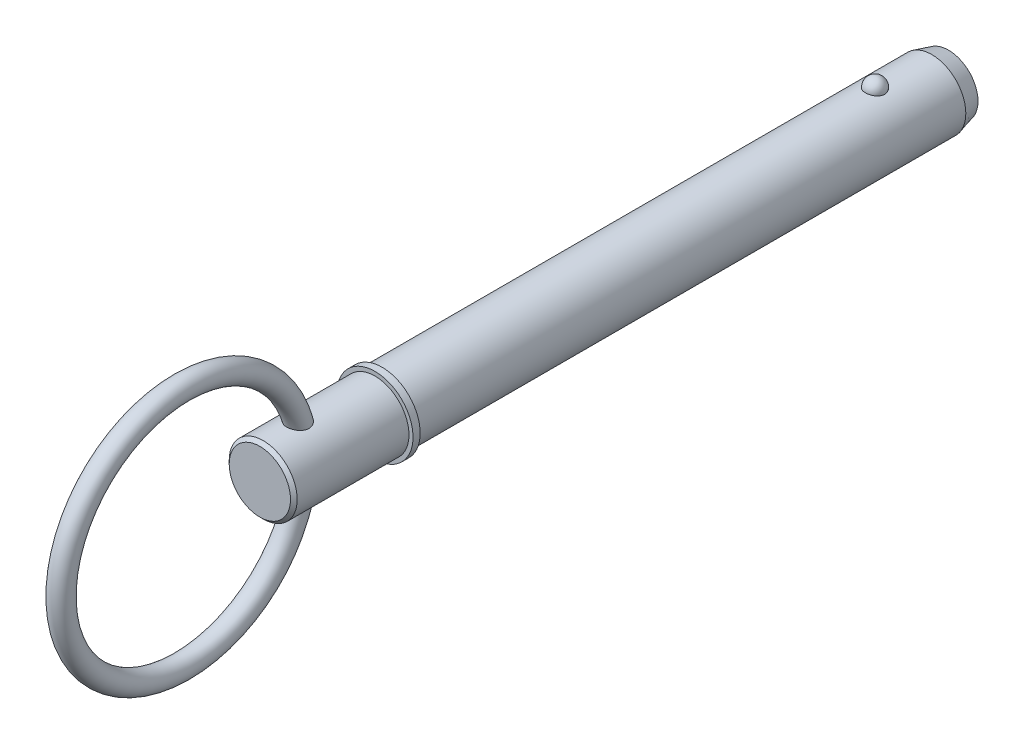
SolidWorks part; units mm, degrees
ref_plane "Front Plane" through (0, 0, 0) normal (0, 0, 1) x (1, 0, 0)
ref_plane "Top Plane" through (0, 0, 0) normal (0, 1, 0) x (1, 0, 0)
ref_plane "Right Plane" through (0, 0, 0) normal (1, 0, 0) x (0, 0, -1)
sketch "Sketch2" plane through (0, 0, 0) normal (0, 0, 1) x (1, 0, 0)
  circle A0 centre (0, 0) radius 7.145
  point P3 (0, 7.145)
  dimension "D1" = 14.29
extrude "Boss-Extrude1" add sketch "Sketch2" along normal blind 101.6
sketch "Sketch3" plane through (0, 0, 0) normal (0, 0, -1) x (-1, 0, 0)
  circle A0 centre (0, 0) radius 7.145
  dimension "D1" = 14.29
extrude "Boss-Extrude2" add sketch "Sketch3" along normal blind 17.45
chamfer "Chamfer1" distance 3.5 angle 15 1 edges at (-7.145, 0, -17.45)
sketch "Sketch18" plane through (0, 0, 0) normal (1, 0, 0) x (0, 0, -1)
  line L0 (13.95, 7.145) -> (-101.6, 7.145) construction
  line L1 (2.02, 9.165) -> (2.02, 5.125)
  line L2 (-101.6, -7.145) -> (13.95, -7.145) construction
  arc A0 (2.02, 9.165) -> (2.02, 5.125) centre (2.02, 7.145) ccw
  point P4 (0, 7.145)
  dimension "D1" = 16.31
revolve "Revolve1" add sketch "Sketch18" angle 360 about L1
sketch "Sketch19" plane through (0, 0, 0) normal (1, 0, 0) x (0, 0, -1)
  line L0 (-33.7288, 0) -> (-46.4542, 0) construction
sketch "Sketch20" plane through (0, 0, 0) normal (1, 0, 0) x (0, 0, -1)
  line L0 (-101.6, 0) -> (-101.6, 8)
  line L1 (-101.6, 7.145) -> (-101.6, -7.145) construction
  line L2 (-101.6, 8) -> (-103.1, 8)
  line L3 (-103.1, 8) -> (-103.1, 0)
  line L4 (-33.7288, 0) -> (-46.4542, 0) construction
  line L5 (-103.1, 0) -> (-101.6, 0)
  dimension "D1" = 8
  dimension "D2" = 1.5
revolve "Revolve2" add sketch "Sketch20" angle 360 about L0
sketch "Sketch21" plane through (0, 0, 101.6) normal (0, 0, -1) x (-1, 0, 0)
  circle A0 centre (0, 0) radius 7.145
  dimension "D1" = 14.29
extrude "Boss-Extrude3" add sketch "Sketch21" against normal blind 25.7
chamfer "Chamfer2" distance 0.7 angle 45 1 edges at (-7.145, 0, 127.3)
sketch "Sketch23" plane through (0, 0, 0) normal (1, 0, 0) x (0, 0, -1)
  line L0 (-127.3, 6.445) -> (-127.3, -6.445) construction
  circle A0 centre (-143.7, 0) radius 25.4
  point P2 (-118.3, 0)
  dimension "D1" = 50.8
  dimension "D2" = 9
sketch "Sketch24" plane through (0, 0, 0) normal (0, 1, 0) x (1, 0, 0)
  circle A0 centre (0, -118.3) radius 2.25
  dimension "D1" = 4.5
sweep "Sweep1" add profiles "Sketch24" path "Sketch23"
